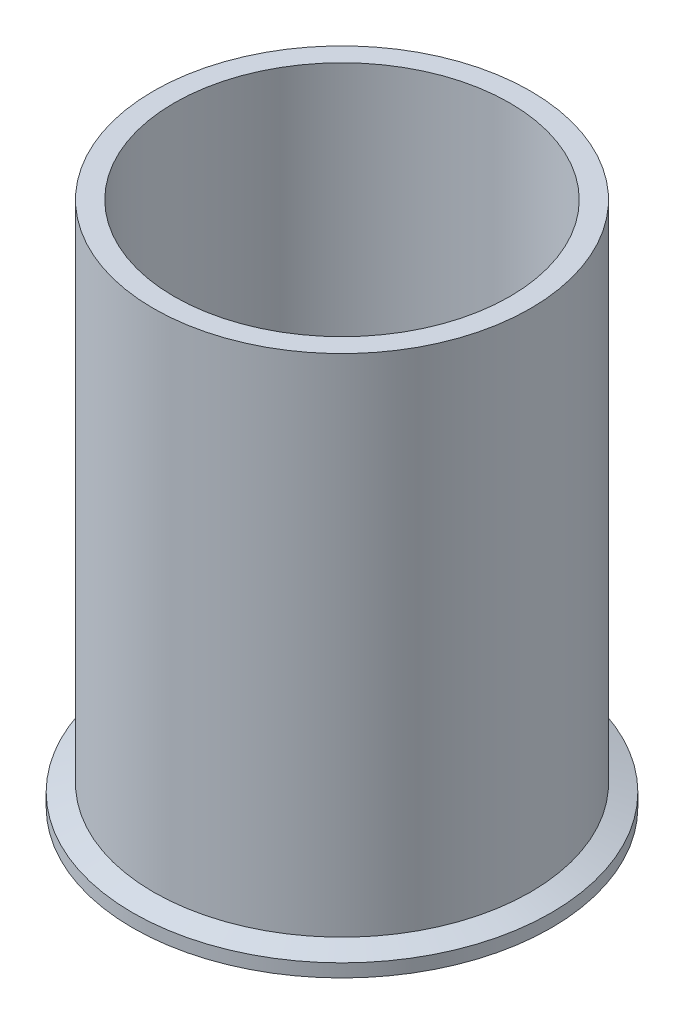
SolidWorks part; units mm, degrees
ref_plane "Front Plane" through (0, 0, 0) normal (0, 0, 1) x (1, 0, 0)
ref_plane "Top Plane" through (0, 0, 0) normal (0, 1, 0) x (1, 0, 0)
ref_plane "Right Plane" through (0, 0, 0) normal (1, 0, 0) x (0, 0, -1)
sketch "Sketch1" plane through (0, 0, 0) normal (0, 0, 1) x (1, 0, 0)
  line L0 (0, 0) -> (0, 114.3) construction
  line L1 (0, 114.3) -> (-40.9448, 114.3)
  line L2 (-40.9448, 114.3) -> (-40.9448, 4.4858)
  line L3 (-40.9448, 4.4858) -> (-45.4533, 2.8448)
  line L4 (-45.4533, 2.8448) -> (-45.4533, 0)
  line L5 (-45.4533, 0) -> (-43.4867, 0)
  line L6 (-39.8507, 0) -> (0, 0)
  line L7 (0, 0) -> (0, 114.3)
  line L8 (0, 114.3) -> (-36.449, 114.3)
  line L9 (-36.449, 114.3) -> (-36.449, 0)
  line L10 (-36.449, 0) -> (0, 0)
  line L11 (0, 0) -> (-0.1846, 0.0129)
  arc A0 (-42.7642, 0.4745) -> (-40.5732, 0.4745) centre (-41.6687, 0) cw
  arc A1 (-39.8507, 0) -> (-40.5732, 0.4745) centre (-39.8507, 0.7874) cw
  arc A2 (-42.7642, 0.4745) -> (-43.4867, 0) centre (-43.4867, 0.7874) cw
  point P12 (-40.4749, 0)
  dimension "D6" = 1.1938
  dimension "D7" = 0.7874
  dimension "D1" = 40.9448
  dimension "D2" = 2.8448
  dimension "D3" = 45.4533
  dimension "D4" = 70
  dimension "D5" = 41.6687
  dimension "D8" = 36.449
  dimension "D9" = 114.3
revolve "Revolve2" add sketch "Sketch1" angle 360 about L0
